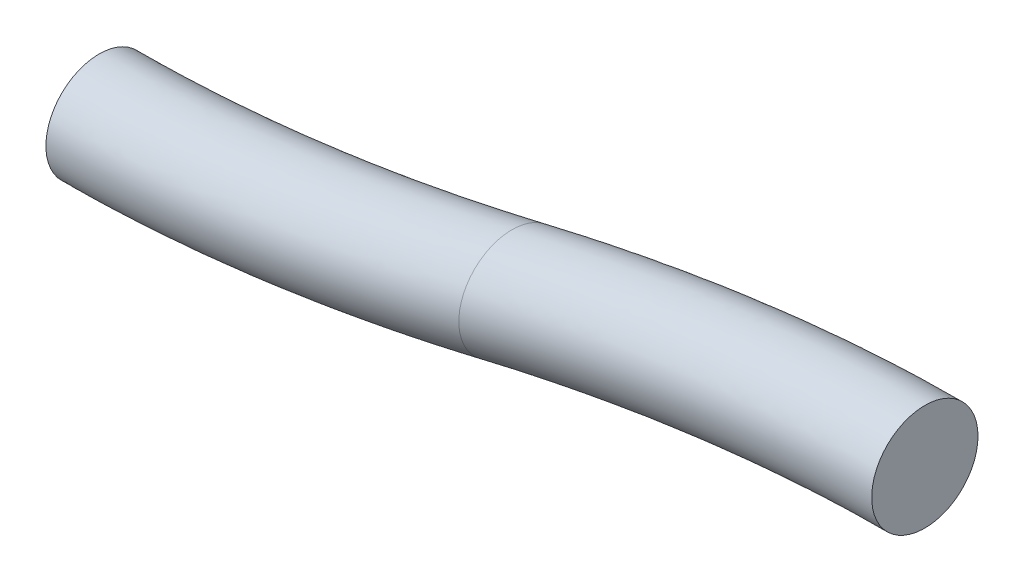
SolidWorks part; units mm, degrees
ref_plane "Front Plane" through (0, 0, 0) normal (0, 0, 1) x (1, 0, 0)
ref_plane "Top Plane" through (0, 0, 0) normal (0, 1, 0) x (1, 0, 0)
ref_plane "Right Plane" through (0, 0, 0) normal (1, 0, 0) x (0, 0, -1)
sketch "Sketch1" plane through (0, 0, 0) normal (0, 1, 0) x (1, 0, 0)
  line L0 (0, 0) -> (64.262, 0) construction
  line L1 (64.262, 0) -> (64.262, 9.7257) construction
  arc A0 (0, 0) -> (32.131, 4.8628) centre (0, 108.5837) ccw
  arc A1 (64.262, 9.7257) -> (32.131, 4.8628) centre (64.262, -98.8581) ccw
  dimension "D1" = 64.262
  dimension "D2" = 9.7257
sketch "Sketch2" plane through (0, 0, 0) normal (1, 0, 0) x (0, 0, -1)
  circle A0 centre (0, 0) radius 4.7625
  dimension "D1" = 9.525
sweep "Sweep1" add profiles "Sketch2" path "Sketch1"
